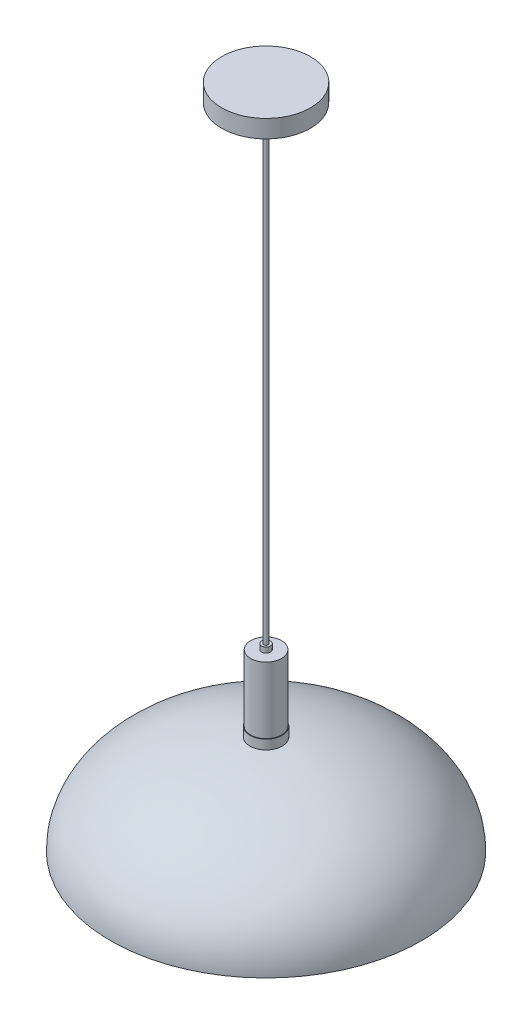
SolidWorks part; units mm, degrees
ref_plane "Alzado" through (0, 0, 0) normal (0, 0, 1) x (1, 0, 0)
ref_plane "Planta" through (0, 0, 0) normal (0, 1, 0) x (1, 0, 0)
ref_plane "Vista lateral" through (0, 0, 0) normal (1, 0, 0) x (0, 0, -1)
sketch "Croquis1" plane through (0, 0, 0) normal (0, 0, 1) x (1, 0, 0)
  line L0 (0, 0) -> (0, 750)
  line L1 (0, 750) -> (50, 750)
  line L2 (50, 750) -> (50, 730)
  line L3 (50, 730) -> (5, 730)
  line L4 (0, 0) -> (175, 0)
  line L5 (175, 0) -> (175, 55.0247) construction
  line L6 (175, 55.0247) -> (120.314, 94.2683) construction
  line L7 (120.314, 94.2683) -> (61.4771, 108.3432) construction
  line L8 (61.4771, 108.3432) -> (18.1247, 111.4551) construction
  line L9 (5, 202.5414) -> (5, 196.6394)
  line L10 (5, 196.6394) -> (17.406, 196.6394)
  line L11 (17.406, 196.6394) -> (17.406, 122.0022)
  line L12 (17.406, 122.0022) -> (18.1247, 122.0022)
  line L13 (18.1247, 122.0022) -> (18.1247, 111.4551)
  line L14 (5, 202.5414) -> (2.5, 202.5414)
  line L15 (2.5, 202.5414) -> (2.5, 730)
  line L16 (2.5, 730) -> (5, 730)
  spline S0 degree 4 poles (175, 0) (175, 55.0247) (120.314, 94.2683) (61.4771, 108.3432) (18.1247, 111.4551) knots 0 0 0 0 0 1 1 1 1 1
  dimension "D1" = 750
  dimension "D2" = 50
revolve "Revolución1" add sketch "Croquis1" angle 360 about L0
shell "Vaciado1" thickness 3
